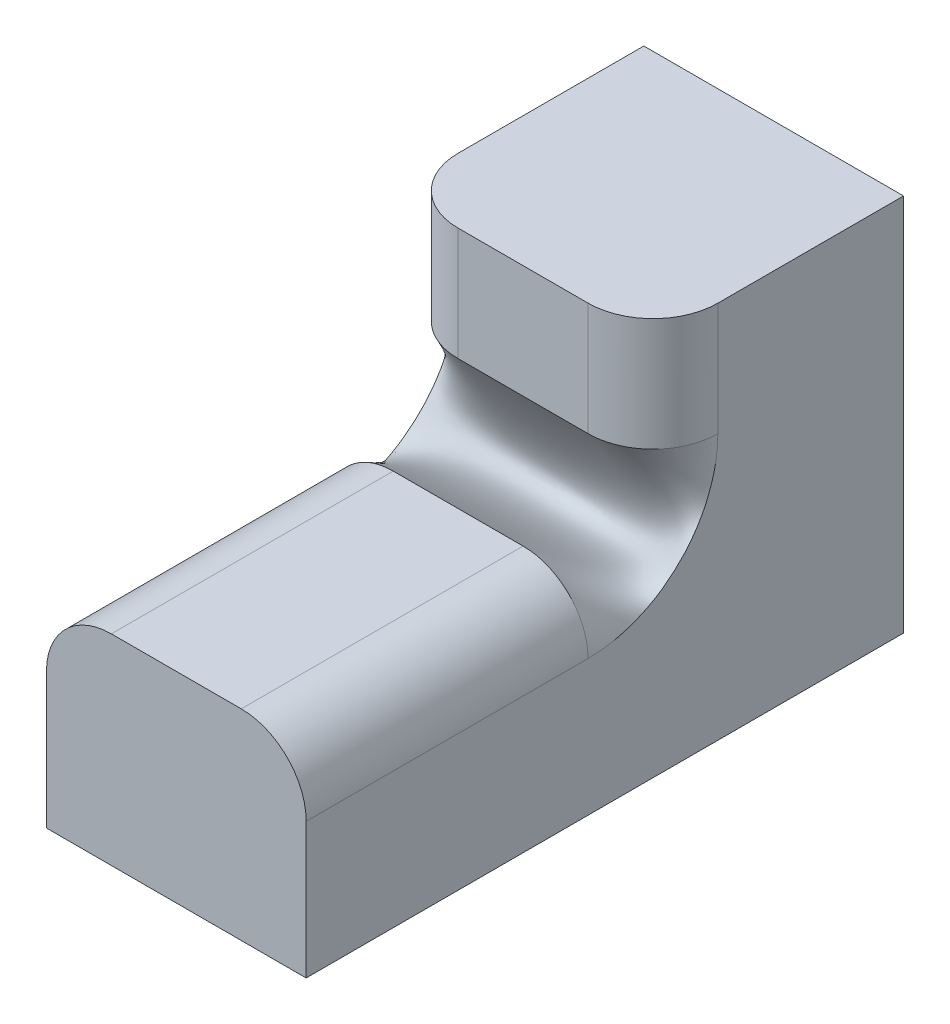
SolidWorks part; units mm, degrees
ref_plane "Front Plane" through (0, 0, 0) normal (0, 0, 1) x (1, 0, 0)
ref_plane "Top Plane" through (0, 0, 0) normal (0, 1, 0) x (1, 0, 0)
ref_plane "Right Plane" through (0, 0, 0) normal (1, 0, 0) x (0, 0, -1)
sketch "Sketch1" plane through (0, 0, 0) normal (1, 0, 0) x (0, 0, -1)
  line L0 (0, 0) -> (-92.0082, 0)
  line L1 (-92.0082, 0) -> (-92.0082, 30.9025)
  line L2 (-92.0082, 30.9025) -> (-38.5931, 30.9025)
  line L3 (-38.5931, 30.9025) -> (-38.5931, 58.3092)
  line L4 (-38.5931, 58.3092) -> (0, 58.3092)
  line L5 (0, 58.3092) -> (0, 0)
extrude "Boss-Extrude1" add sketch "Sketch1" along normal mid plane 40
fillet "Fillet1" radius 10 5 edges at (0, 30.9025, 38.5931) (20, 44.6058, 38.5931) (-20, 44.6058, 38.5931) (-20, 30.9025, 65.3007) (20, 30.9025, 65.3007)
other "DeleteFace2"
